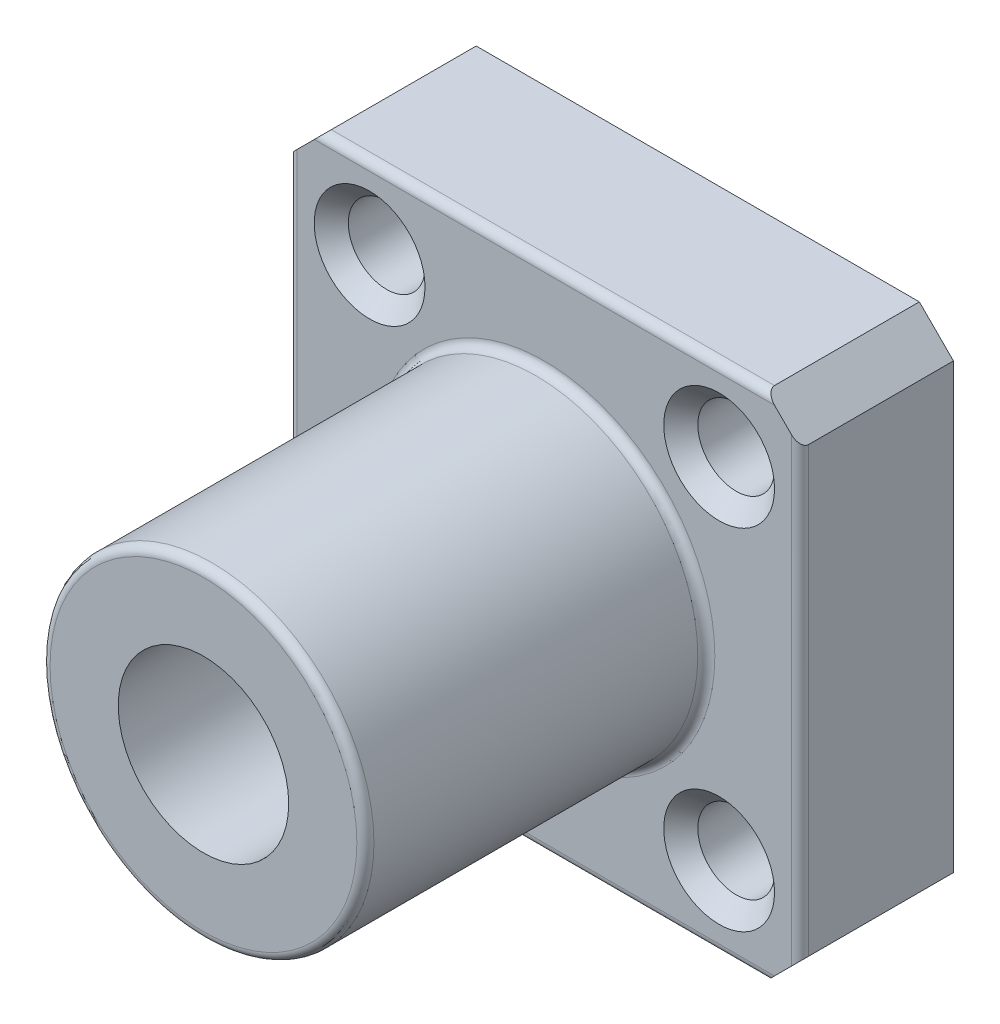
SolidWorks part; units mm, degrees
ref_plane "Front Plane" through (0, 0, 0) normal (0, 0, 1) x (1, 0, 0)
ref_plane "Top Plane" through (0, 0, 0) normal (0, 1, 0) x (1, 0, 0)
ref_plane "Right Plane" through (0, 0, 0) normal (1, 0, 0) x (0, 0, -1)
sketch "Sketch1" plane through (0, 0, 0) normal (0, 0, 1) x (1, 0, 0)
  line L1 (-15, 15) -> (15, 15)
  line L2 (-15, 15) -> (-15, -15)
  line L3 (-15, -15) -> (15, -15)
  line L4 (15, 15) -> (15, -15)
  line L5 (-15, 15) -> (15, -15) construction
  line L6 (-15, -15) -> (15, 15) construction
  point P0 (0, 0)
  dimension "D1" = 30
  dimension "D2" = 30
extrude "Boss-Extrude1" add sketch "Sketch1" along normal blind 9
sketch "Sketch2" plane through (0, 0, 9) normal (0, 0, 1) x (1, 0, 0)
  circle A0 centre (0, 0) radius 9.5
  dimension "D1" = 19
extrude "Boss-Extrude2" add sketch "Sketch2" along normal blind 20
sketch "Sketch3" plane through (0, 0, 29) normal (0, 0, 1) x (1, 0, 0)
  circle A0 centre (0, 0) radius 5
  dimension "D1" = 10
extrude "Cut-Extrude1" cut sketch "Sketch3" against normal through all
sketch "Sketch4" plane through (0, 0, 0) normal (0, 0, -1) x (-1, 0, 0)
  line L0 (0, 0) -> (-15, 15) construction
  circle A0 centre (-10.253, 10.253) radius 2.25
  circle A1 centre (0, 0) radius 5 construction
  dimension "D1" = 4.5
  dimension "D2" = 14.5
extrude "Cut-Extrude2" cut sketch "Sketch4" against normal through all
chamfer "Chamfer1" distance 1 angle 45 1 edges at (12.503, 10.253, 9)
pattern_circular "CirPattern1" count 4 over 360 about axis through (0, 0, 0) along (0, 0, 1) of "Chamfer1", "Cut-Extrude2"
fillet "Fillet1" radius 0.5 6 edges at (9.5, 0, 9) (9.5, 0, 29) (0, -15, 9) (15, 0, 9) (-15, 0, 9) (0, 15, 9)
chamfer "Chamfer2" distance 2 angle 45 4 edges at (15, -15, 4.25) (-15, -15, 4.25) (15, 15, 4.25) (-15, 15, 4.25)
